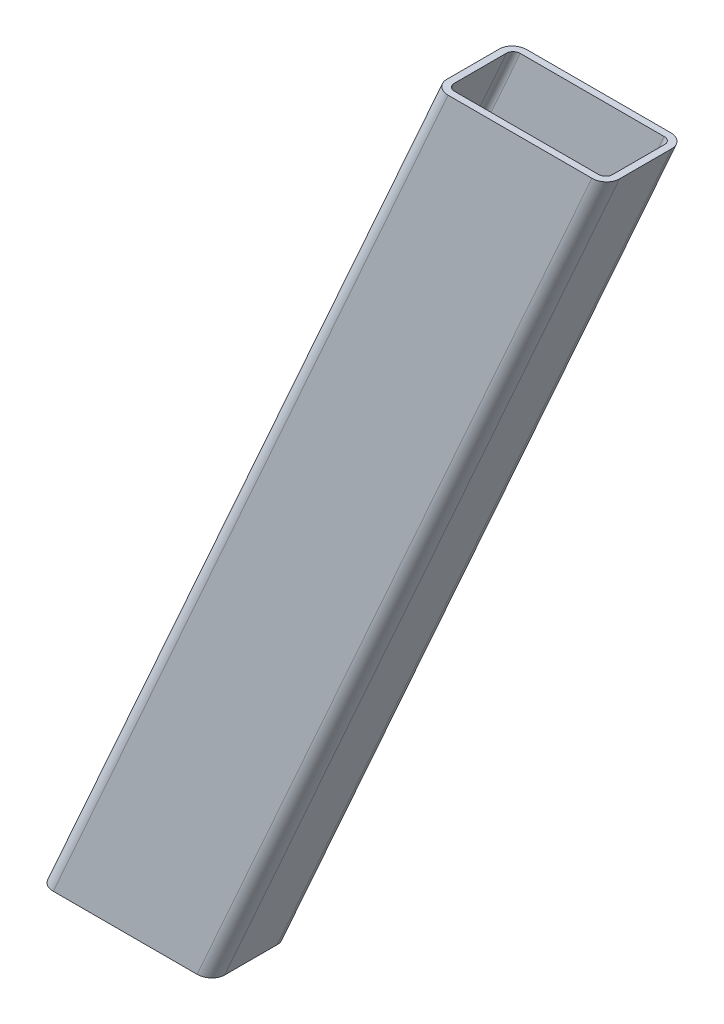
SolidWorks part; units mm, degrees
ref_plane "Front Plane" through (0, 0, 0) normal (0, 0, 1) x (1, 0, 0)
ref_plane "Top Plane" through (0, 0, 0) normal (0, 1, 0) x (1, 0, 0)
ref_plane "Right Plane" through (0, 0, 0) normal (1, 0, 0) x (0, 0, -1)
sketch "Sketch1" plane through (0, 0, 0) normal (0, 0, 1) x (1, 0, 0)
  line L0 (329.3383, -382.6216) -> (-433.8617, -2097.1216)
  line L1 (-1143.8617, -382.6216) -> (481.7383, -382.6216) construction
  line L2 (-1443.8617, -2097.1216) -> (-443.8617, -2097.1216) construction
  dimension "D1" = 152.4
  dimension "D2" = 10
other "Structural Member2"
ref_plane "Plane2" through (190.1096, -320.6448, -76.2) normal (-0.4067, -0.9136, 0) x (0, 0, 1)
sketch "Sketch12" plane through (190.1096, -320.6448, -76.2) normal (-0.4067, -0.9136, 0) x (0, 0, 1)
  line L0 (-50.8, -139.7) -> (50.8, -139.7)
  line L1 (-63.5, -127) -> (-63.5, 127)
  line L2 (50.8, 139.7) -> (-50.8, 139.7)
  line L3 (63.5, 127) -> (63.5, -127)
  line L4 (-50.8, -152.4) -> (50.8, -152.4)
  line L5 (-76.2, -127) -> (-76.2, 127)
  line L6 (50.8, 152.4) -> (-50.8, 152.4)
  line L7 (76.2, 127) -> (76.2, -127)
  line L8 (0, 152.4) -> (0, 139.7) construction
  line L9 (0, 139.7) -> (0, -139.7) construction
  line L10 (0, -139.7) -> (0, -152.4) construction
  line L11 (-76.2, 0) -> (-63.5, 0) construction
  line L12 (-63.5, 0) -> (63.5, 0) construction
  line L13 (63.5, 0) -> (76.2, 0) construction
  arc A0 (76.2, 127) -> (50.8, 152.4) centre (50.8, 127) ccw
  arc A1 (50.8, -152.4) -> (76.2, -127) centre (50.8, -127) ccw
  arc A2 (-76.2, -127) -> (-50.8, -152.4) centre (-50.8, -127) ccw
  arc A3 (-50.8, 152.4) -> (-76.2, 127) centre (-50.8, 127) ccw
  arc A4 (-50.8, 139.7) -> (-63.5, 127) centre (-50.8, 127) ccw
  arc A5 (63.5, 127) -> (50.8, 139.7) centre (50.8, 127) ccw
  arc A6 (50.8, -139.7) -> (63.5, -127) centre (50.8, -127) ccw
  arc A7 (-63.5, -127) -> (-50.8, -139.7) centre (-50.8, -127) ccw
  point P6 (-76.2, 152.4)
  point P33 (76.2, 152.4)
  point P35 (-76.2, -152.4)
  point P36 (76.2, -152.4)
  point P37 (0, 0)
  dimension "D1" = 25.4
  dimension "Thickness" = 12.7
  dimension "V_leg" = 304.8
  dimension "H_leg" = 152.4
other "Trim/Extend1"
other "Trim/Extend2"
